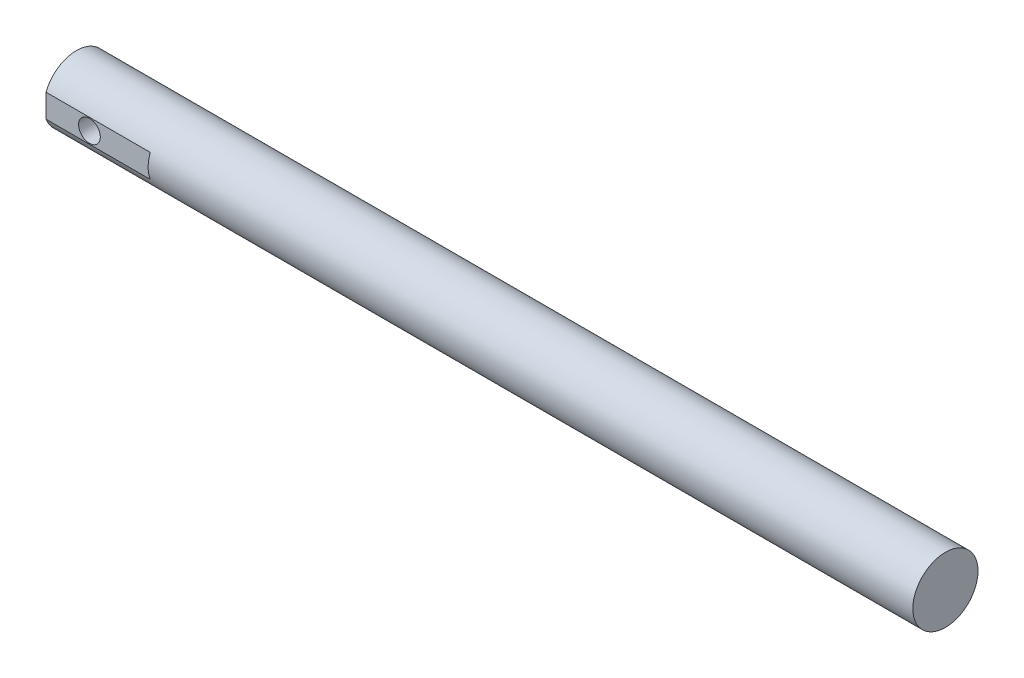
SolidWorks part; units mm, degrees
ref_plane "Front Plane" through (0, 0, 0) normal (0, 0, 1) x (1, 0, 0)
ref_plane "Top Plane" through (0, 0, 0) normal (0, 1, 0) x (1, 0, 0)
ref_plane "Right Plane" through (0, 0, 0) normal (1, 0, 0) x (0, 0, -1)
sketch "Sketch1" plane through (0, 0, 0) normal (1, 0, 0) x (0, 0, -1)
  circle A0 centre (0, 0) radius 4.7625
extrude "Boss-Extrude1" add sketch "Sketch1" along normal blind 127
sketch "Sketch2" plane through (0, 0, 0) normal (-1, 0, 0) x (0, 0, 1)
  line L1 (-4.445, 5.275) -> (4.445, 5.275)
  line L2 (-4.445, 5.275) -> (-4.445, -5.3962)
  line L3 (-4.445, -5.3962) -> (4.445, -5.3962)
  line L4 (4.445, 5.275) -> (4.445, -5.3962)
  dimension "D1" = 8.89
  dimension "D2" = 4.445
extrude "Cut-Extrude1" cut sketch "Sketch2" against normal blind 15.24 contours L4 M1 | L2 M1
sketch "Sketch3" plane through (0, 0, 4.445) normal (0, 0, 1) x (1, 0, 0)
  circle A0 centre (6.35, 0) radius 1.5875
  dimension "D1" = 6.35
extrude "Cut-Extrude2" cut sketch "Sketch3" against normal through all
